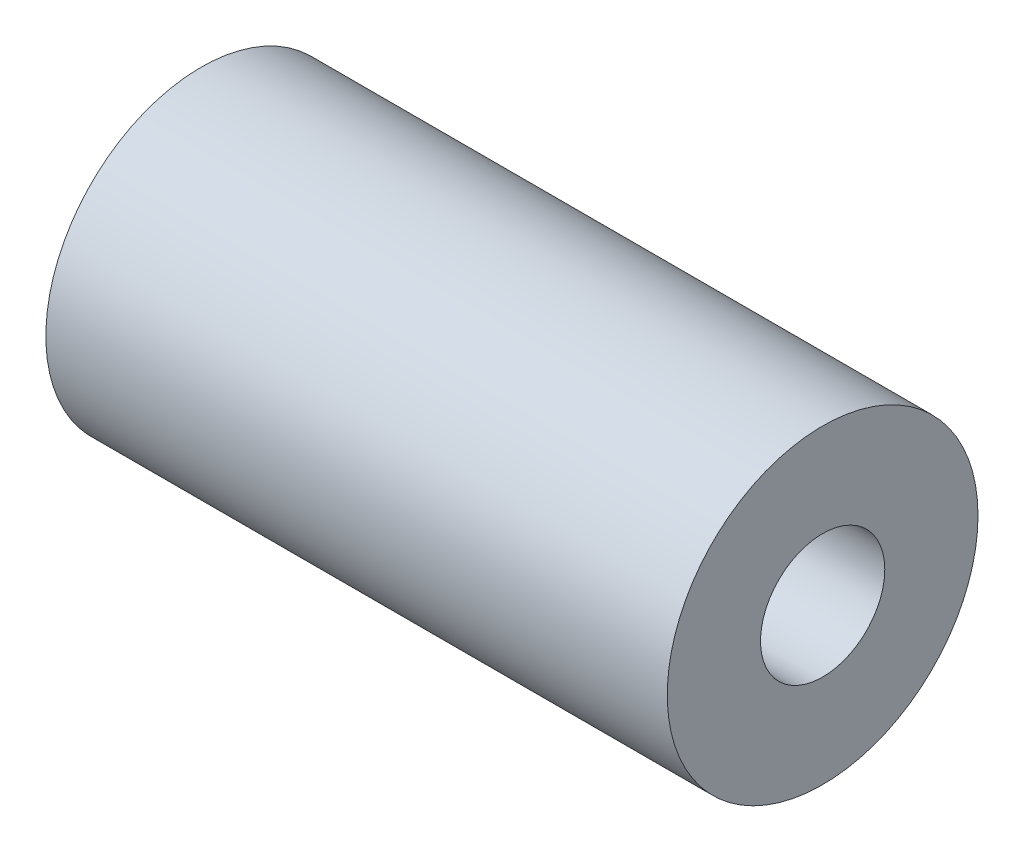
SolidWorks part; units mm, degrees
ref_plane "Front Plane" through (0, 0, 0) normal (0, 0, 1) x (1, 0, 0)
ref_plane "Top Plane" through (0, 0, 0) normal (0, 1, 0) x (1, 0, 0)
ref_plane "Right Plane" through (0, 0, 0) normal (1, 0, 0) x (0, 0, -1)
sketch "Sketch1" plane through (0, 0, 0) normal (1, 0, 0) x (0, 0, -1)
  circle A0 centre (0, 0) radius 5
  circle A1 centre (0, 0) radius 12.5
  dimension "D1" = 10
  dimension "D2" = 25
extrude "Boss-Extrude1" add sketch "Sketch1" along normal blind 50
